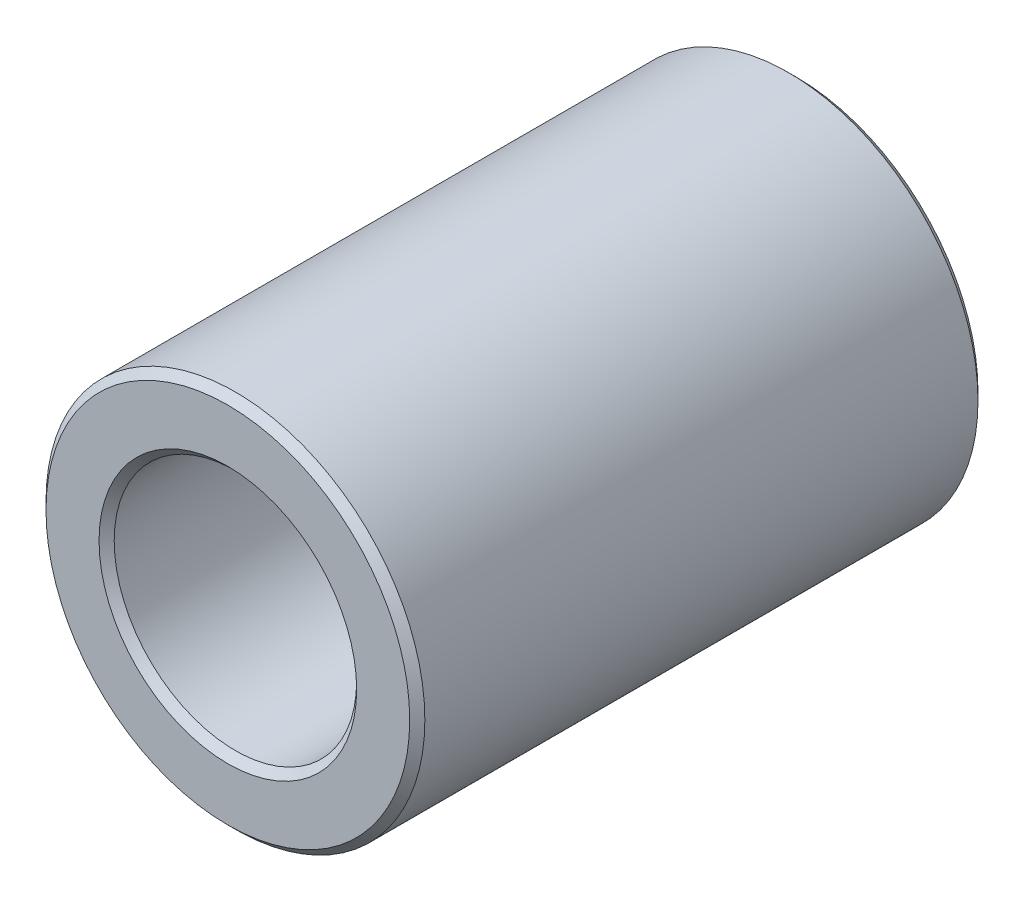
SolidWorks part; units mm, degrees
ref_plane "Front Plane" through (0, 0, 0) normal (0, 0, 1) x (1, 0, 0)
ref_plane "Top Plane" through (0, 0, 0) normal (0, 1, 0) x (1, 0, 0)
ref_plane "Right Plane" through (0, 0, 0) normal (1, 0, 0) x (0, 0, -1)
sketch "Sketch1" plane through (0, 0, 0) normal (0, 0, 1) x (1, 0, 0)
  circle A0 centre (0, 0) radius 5
  circle A1 centre (0, 0) radius 3.2
  dimension "D1" = 10
  dimension "D2" = 6.4
extrude "Boss-Extrude2" add sketch "Sketch1" along normal mid plane 15
chamfer "Chamfer3" distance 0.2 angle 45 4 edges at (5, 0, 7.5) (5, 0, -7.5) (3.2, 0, -7.5) (3.2, 0, 7.5)
